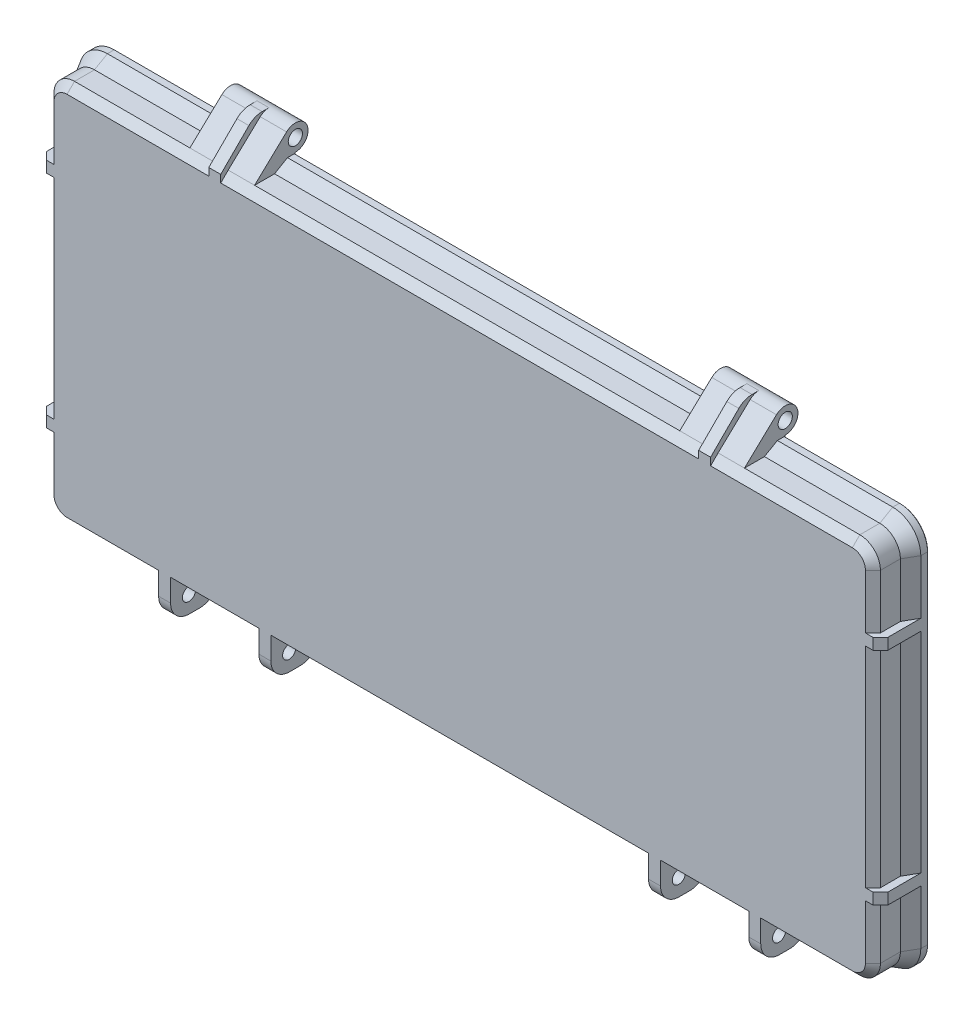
SolidWorks part; units mm, degrees
ref_plane "Front Plane" through (0, 0, 0) normal (0, 0, 1) x (1, 0, 0)
ref_plane "Top Plane" through (0, 0, 0) normal (0, 1, 0) x (1, 0, 0)
ref_plane "Right Plane" through (0, 0, 0) normal (1, 0, 0) x (0, 0, -1)
sketch "Sketch1" plane through (0, 0, 0) normal (0, 0, 1) x (1, 0, 0)
  line L1 (-105, 51) -> (105, 51)
  line L2 (-110.5, 45.5) -> (-110.5, -45.5)
  line L3 (-105, -51) -> (105, -51)
  line L4 (110.5, 45.5) -> (110.5, -45.5)
  line L5 (-110.5, 51) -> (110.5, -51) construction
  line L6 (-110.5, -51) -> (110.5, 51) construction
  arc A0 (-110.5, -45.5) -> (-105, -51) centre (-105, -45.5) ccw
  arc A1 (105, -51) -> (110.5, -45.5) centre (105, -45.5) ccw
  arc A2 (105, 51) -> (110.5, 45.5) centre (105, 45.5) cw
  arc A3 (-105, 51) -> (-110.5, 45.5) centre (-105, 45.5) ccw
  point P0 (0, 0)
  dimension "D3" = 5.5
  dimension "D1" = 221
  dimension "D2" = 102
extrude "Boss-Extrude1" add sketch "Sketch1" along normal blind 2 draft 45
sketch "Sketch2" plane through (0, 0, 0) normal (0, 0, -1) x (-1, 0, 0)
  line L4 (110.5, -45.5) -> (110.5, 45.5)
  line L5 (105, 51) -> (-105, 51)
  line L6 (-110.5, 45.5) -> (-110.5, -45.5)
  line L7 (-105, -51) -> (105, -51)
  line L8 (110.5, -45.5) -> (110.5, 45.5)
  line L9 (105, 51) -> (-105, 51)
  line L10 (-110.5, 45.5) -> (-110.5, -45.5)
  line L11 (-105, -51) -> (105, -51)
  arc A4 (105, -51) -> (110.5, -45.5) centre (105, -45.5) ccw
  arc A5 (110.5, 45.5) -> (105, 51) centre (105, 45.5) ccw
  arc A6 (-105, 51) -> (-110.5, 45.5) centre (-105, 45.5) ccw
  arc A7 (-110.5, -45.5) -> (-105, -51) centre (-105, -45.5) ccw
  arc A8 (105, -51) -> (110.5, -45.5) centre (105, -45.5) ccw
  arc A9 (110.5, 45.5) -> (105, 51) centre (105, 45.5) ccw
  arc A10 (-105, 51) -> (-110.5, 45.5) centre (-105, 45.5) ccw
  arc A11 (-110.5, -45.5) -> (-105, -51) centre (-105, -45.5) ccw
  dimension "D1" = 0
extrude "Boss-Extrude2" add sketch "Sketch2" along normal blind 8.8
sketch "Sketch3" plane through (0, 0, -8.8) normal (0, 0, -1) x (-1, 0, 0)
  line L8 (112.5, -45.5) -> (112.5, 45.5)
  line L9 (105, 53) -> (-105, 53)
  line L10 (-112.5, 45.5) -> (-112.5, -45.5)
  line L11 (-105, -53) -> (105, -53)
  line L12 (112.5, -45.5) -> (112.5, 45.5)
  line L13 (105, 53) -> (-105, 53)
  line L14 (-112.5, 45.5) -> (-112.5, -45.5)
  line L15 (-105, -53) -> (105, -53)
  arc A8 (105, -53) -> (112.5, -45.5) centre (105, -45.5) ccw
  arc A9 (112.5, 45.5) -> (105, 53) centre (105, 45.5) ccw
  arc A10 (-105, 53) -> (-112.5, 45.5) centre (-105, 45.5) ccw
  arc A11 (-112.5, -45.5) -> (-105, -53) centre (-105, -45.5) ccw
  arc A12 (105, -53) -> (112.5, -45.5) centre (105, -45.5) ccw
  arc A13 (112.5, 45.5) -> (105, 53) centre (105, 45.5) ccw
  arc A14 (-105, 53) -> (-112.5, 45.5) centre (-105, 45.5) ccw
  arc A15 (-112.5, -45.5) -> (-105, -53) centre (-105, -45.5) ccw
  dimension "D1" = 2
extrude "Boss-Extrude3" add sketch "Sketch3" along normal blind 2
sketch "Sketch4" plane through (0, 0, -8.8) normal (0, 0, 1) x (1, 0, 0)
  line L4 (-105, -53) -> (105, -53)
  line L5 (112.5, -45.5) -> (112.5, 45.5)
  line L6 (105, 53) -> (-105, 53)
  line L7 (-112.5, 45.5) -> (-112.5, -45.5)
  line L8 (-105, -53) -> (105, -53)
  line L9 (112.5, -45.5) -> (112.5, 45.5)
  line L10 (105, 53) -> (-105, 53)
  line L11 (-112.5, 45.5) -> (-112.5, -45.5)
  arc A4 (-112.5, -45.5) -> (-105, -53) centre (-105, -45.5) ccw
  arc A5 (105, -53) -> (112.5, -45.5) centre (105, -45.5) ccw
  arc A6 (112.5, 45.5) -> (105, 53) centre (105, 45.5) ccw
  arc A7 (-105, 53) -> (-112.5, 45.5) centre (-105, 45.5) ccw
  arc A8 (-112.5, -45.5) -> (-105, -53) centre (-105, -45.5) ccw
  arc A9 (105, -53) -> (112.5, -45.5) centre (105, -45.5) ccw
  arc A10 (112.5, 45.5) -> (105, 53) centre (105, 45.5) ccw
  arc A11 (-105, 53) -> (-112.5, 45.5) centre (-105, 45.5) ccw
  dimension "D1" = 0
extrude "Boss-Extrude4" add sketch "Sketch4" along normal blind 4 draft 30
sketch "Sketch5" plane through (0, 0, -10.8) normal (0, 0, -1) x (-1, 0, 0)
  line L4 (109.45, -45.5) -> (109.45, 45.5)
  line L5 (105, 49.95) -> (-105, 49.95)
  line L6 (-109.45, 45.5) -> (-109.45, -45.5)
  line L7 (-105, -49.95) -> (105, -49.95)
  line L8 (111.05, -45.5) -> (111.05, 45.5)
  line L9 (105, 51.55) -> (-105, 51.55)
  line L10 (-111.05, 45.5) -> (-111.05, -45.5)
  line L11 (-105, -51.55) -> (105, -51.55)
  line L12 (111.05, -45.5) -> (111.05, 45.5)
  line L13 (105, 51.55) -> (-105, 51.55)
  line L14 (-111.05, 45.5) -> (-111.05, -45.5)
  line L15 (-105, -51.55) -> (105, -51.55)
  arc A4 (109.45, 45.5) -> (105, 49.95) centre (105, 45.5) ccw
  arc A5 (-105, 49.95) -> (-109.45, 45.5) centre (-105, 45.5) ccw
  arc A6 (-109.45, -45.5) -> (-105, -49.95) centre (-105, -45.5) ccw
  arc A7 (105, -49.95) -> (109.45, -45.5) centre (105, -45.5) ccw
  arc A8 (105, -51.55) -> (111.05, -45.5) centre (105, -45.5) ccw
  arc A9 (111.05, 45.5) -> (105, 51.55) centre (105, 45.5) ccw
  arc A10 (-105, 51.55) -> (-111.05, 45.5) centre (-105, 45.5) ccw
  arc A11 (-111.05, -45.5) -> (-105, -51.55) centre (-105, -45.5) ccw
  arc A12 (105, -51.55) -> (111.05, -45.5) centre (105, -45.5) ccw
  arc A13 (111.05, 45.5) -> (105, 51.55) centre (105, 45.5) ccw
  arc A14 (-105, 51.55) -> (-111.05, 45.5) centre (-105, 45.5) ccw
  arc A15 (-111.05, -45.5) -> (-105, -51.55) centre (-105, -45.5) ccw
  dimension "D1" = 1.45
  dimension "D2" = 1.6
extrude "Boss-Extrude5" add sketch "Sketch5" along normal blind 0.4
sketch "Sketch6" plane through (0, 0, -11.2) normal (0, 0, -1) x (-1, 0, 0)
  line L0 (-105, -49.95) -> (105, -49.95) construction
  line L1 (109.45, -45.5) -> (109.45, 45.5) construction
  line L2 (105, 49.95) -> (-105, 49.95) construction
  line L3 (-109.45, 45.5) -> (-109.45, -45.5) construction
  line L4 (111.05, -45.5) -> (111.05, 45.5)
  line L5 (105, 51.55) -> (-105, 51.55)
  line L6 (-111.05, 45.5) -> (-111.05, -45.5)
  line L7 (-105, -51.55) -> (105, -51.55)
  line L8 (111.05, -45.5) -> (111.05, 45.5)
  line L9 (105, 51.55) -> (-105, 51.55)
  line L10 (-111.05, 45.5) -> (-111.05, -45.5)
  line L11 (-105, -51.55) -> (105, -51.55)
  line L12 (-105, -49.95) -> (105, -49.95)
  line L13 (109.45, -45.5) -> (109.45, 45.5)
  line L14 (105, 49.95) -> (-105, 49.95)
  line L15 (-109.45, 45.5) -> (-109.45, -45.5)
  arc A0 (-109.45, -45.5) -> (-105, -49.95) centre (-105, -45.5) ccw construction
  arc A1 (105, -49.95) -> (109.45, -45.5) centre (105, -45.5) ccw construction
  arc A2 (109.45, 45.5) -> (105, 49.95) centre (105, 45.5) ccw construction
  arc A3 (-105, 49.95) -> (-109.45, 45.5) centre (-105, 45.5) ccw construction
  arc A4 (105, -51.55) -> (111.05, -45.5) centre (105, -45.5) ccw
  arc A5 (111.05, 45.5) -> (105, 51.55) centre (105, 45.5) ccw
  arc A6 (-105, 51.55) -> (-111.05, 45.5) centre (-105, 45.5) ccw
  arc A7 (-111.05, -45.5) -> (-105, -51.55) centre (-105, -45.5) ccw
  arc A8 (105, -51.55) -> (111.05, -45.5) centre (105, -45.5) ccw
  arc A9 (111.05, 45.5) -> (105, 51.55) centre (105, 45.5) ccw
  arc A10 (-105, 51.55) -> (-111.05, 45.5) centre (-105, 45.5) ccw
  arc A11 (-111.05, -45.5) -> (-105, -51.55) centre (-105, -45.5) ccw
  arc A12 (-109.45, -45.5) -> (-105, -49.95) centre (-105, -45.5) ccw
  arc A13 (105, -49.95) -> (109.45, -45.5) centre (105, -45.5) ccw
  arc A14 (109.45, 45.5) -> (105, 49.95) centre (105, 45.5) ccw
  arc A15 (-105, 49.95) -> (-109.45, 45.5) centre (-105, 45.5) ccw
  dimension "D1" = 0
extrude "Boss-Extrude6" add sketch "Sketch6" along normal blind 0.6 draft 45
sketch "Sketch7" plane through (0, 0, -10.8) normal (0, 0, -1) x (-1, 0, 0)
  line L5 (-105.45, 48.5) -> (105.45, 48.5)
  line L6 (-108, 45.95) -> (-108, -45.95)
  line L7 (-105.45, -48.5) -> (105.45, -48.5)
  line L8 (108, 45.95) -> (108, -45.95)
  line L9 (-108, 48.5) -> (108, -48.5) construction
  line L10 (-108, -48.5) -> (108, 48.5) construction
  arc A0 (-108, -45.95) -> (-105.45, -48.5) centre (-105.45, -45.95) ccw
  arc A1 (105.45, -48.5) -> (108, -45.95) centre (105.45, -45.95) ccw
  arc A2 (105.45, 48.5) -> (108, 45.95) centre (105.45, 45.95) cw
  arc A3 (-105.45, 48.5) -> (-108, 45.95) centre (-105.45, 45.95) ccw
  point P0 (0, 0)
  dimension "D3" = 0
  dimension "D4" = 2.55
  dimension "D1" = 216
  dimension "D2" = 97
extrude "Cut-Extrude1" cut sketch "Sketch7" against normal offset from surface (10.8 mm away) 2
chamfer "Chamfer1" distance 0.2 angle 45 16 edges at (0, 48.5, -10.8) (107.2531, 47.7531, -10.8) (-107.2531, 47.7531, -10.8) (108, 0, -10.8) (-108, 0, -10.8) (107.2531, -47.7531, -10.8) (-107.2531, -47.7531, -10.8) (0, -48.5, -10.8) (0, 53, -10.8) (110.3033, 50.8033, -10.8) (-110.3033, 50.8033, -10.8) (112.5, 0, -10.8) (-112.5, 0, -10.8) (110.3033, -50.8033, -10.8) (-110.3033, -50.8033, -10.8) (0, -53, -10.8)
ref_plane "Plane 45mm" through (-65.5, 0, 0) normal (-1, 0, 0) x (0, 0, 1)
ref_plane "Plane 110.5mm" through (0, 0, 0) normal (-1, 0, 0) x (0, 0, 1)
ref_plane "Plane 30mm" through (-80.5, 0, 0) normal (-1, 0, 0) x (0, 0, 1)
sketch "Sketch8" plane through (-65.5, 0, 0) normal (-1, 0, 0) x (0, 0, 1)
  line L0 (-5.3359, 51) -> (-8.8, 53) construction
  line L1 (-10.6, 53) -> (-8.8, 53) construction
  line L2 (-10.8, 52.8) -> (-10.6, 53) construction
  line L3 (-5.3359, 51) -> (-8.8, 53)
  line L4 (-10.6, 53) -> (-8.8, 53)
  line L5 (-10.8, 52.8) -> (-10.6, 53)
  line L6 (-10.8, 52.8) -> (-10.8, 45.5) construction
  line L7 (-10.9, 53.2) -> (-10.8, 53.1)
  line L8 (-10.8, 53.1) -> (-10.8, 52.8)
  line L9 (-5.3359, 51) -> (0, 51) construction
  line L10 (-5.3359, 51) -> (0, 51)
  line L11 (0, 51) -> (-8.5682, 59.0744)
  arc A0 (-8.5682, 59.0744) -> (-10.9, 53.2) centre (-10.9, 56.6) ccw
  circle A1 centre (-10.9, 56.6) radius 1.9
  point P10 (0, 0)
  point P13 (0, 0)
  point P14 (0, 0)
  point P15 (0, 0)
  dimension "D1" = 6.8
  dimension "D6" = 3.8
  dimension "D2" = 0.1
  dimension "D3" = 135
  dimension "D4" = 0.2
  dimension "D5" = 43.301
extrude "Boss-Extrude7" add sketch "Sketch8" along normal mid plane 17.3
sketch "Sketch9" plane through (-65.5, 0, 0) normal (-1, 0, 0) x (0, 0, 1)
  line L0 (-5.3359, 51) -> (0, 51) construction
  line L1 (-8.8, 53) -> (-5.3359, 51) construction
  line L2 (-10.6, 53) -> (-8.8, 53) construction
  line L3 (-10.8, 52.8) -> (-10.6, 53) construction
  line L4 (-10.8, 53.1) -> (-10.8, 52.8) construction
  line L5 (-10.9, 53.2) -> (-10.8, 53.1) construction
  line L6 (-5.3359, 51) -> (0, 51)
  line L7 (-8.8, 53) -> (-5.3359, 51)
  line L8 (-10.6, 53) -> (-8.8, 53)
  line L9 (-10.8, 52.8) -> (-10.6, 53)
  line L10 (-10.8, 53.1) -> (-10.8, 52.8)
  line L11 (-10.9, 53.2) -> (-10.8, 53.1)
  line L12 (2, 49) -> (0, 51) construction
  line L13 (2, 49) -> (0, 51)
  line L14 (2, 49) -> (2, 51)
  line L15 (-10.9, 60) -> (-9.0711, 60)
  line L16 (-5.5355, 58.5355) -> (2, 51)
  arc A0 (-8.5682, 59.0744) -> (-10.9, 53.2) centre (-10.9, 56.6) ccw construction
  arc A1 (-10.9, 60) -> (-10.9, 53.2) centre (-10.9, 56.6) ccw
  arc A2 (-9.0711, 60) -> (-5.5355, 58.5355) centre (-9.0711, 55) cw
  circle A3 centre (-10.9, 56.6) radius 1.9 construction
  circle A4 centre (-10.9, 56.6) radius 1.9
  dimension "D1" = 5
extrude "Boss-Extrude8" add sketch "Sketch9" along normal mid plane 3.2
mirror "Mirror1" about plane through (0, 0, 0) normal (-1, 0, 0) of "Boss-Extrude8", "Boss-Extrude7"
sketch "Sketch10" plane through (-80.5, 0, 0) normal (-1, 0, 0) x (0, 0, 1)
  line L0 (2, -49) -> (0, -51) construction
  line L1 (-5.3359, -51) -> (0, -51) construction
  line L2 (-5.3359, -51) -> (-8.8, -53) construction
  line L3 (-10.6, -53) -> (-8.8, -53) construction
  line L4 (-10.8, -52.8) -> (-10.6, -53) construction
  line L5 (2, -49) -> (0, -51)
  line L6 (-5.3359, -51) -> (0, -51)
  line L7 (-5.3359, -51) -> (-8.8, -53)
  line L8 (-10.6, -53) -> (-8.8, -53)
  line L9 (-10.8, -52.8) -> (-10.6, -53)
  line L10 (-10.8, -52.8) -> (-10.8, -55)
  line L11 (-5.8, -60) -> (-3, -60)
  line L12 (2, -55) -> (2, -49)
  line L13 (-10.8, -45.5) -> (-10.8, -52.8) construction
  arc A0 (-3, -60) -> (2, -55) centre (-3, -55) ccw
  arc A1 (-10.8, -55) -> (-5.8, -60) centre (-5.8, -55) ccw
  circle A2 centre (-2.9, -55.3) radius 1.75
  dimension "D2" = 5
  dimension "D3" = 3.5
  dimension "D1" = 7
  dimension "D4" = 2.3
  dimension "D5" = 7.9
extrude "Boss-Extrude9" add sketch "Sketch10" against normal blind 3.2
mirror "Mirror2" about plane through (-65.5, 0, 0) normal (-1, 0, 0) of "Boss-Extrude9"
mirror "Mirror3" about plane through (0, 0, 0) normal (-1, 0, 0) of "Mirror2", "Boss-Extrude9"
ref_plane "PlaneY 20mm" through (0, -31, 0) normal (0, -1, 0) x (-1, 0, 0)
sketch "Sketch11" plane through (0, -31, 0) normal (0, -1, 0) x (-1, 0, 0)
  line L0 (108.5, -2) -> (110.5, 0) construction
  line L1 (110.5, 5.3359) -> (110.5, 0) construction
  line L2 (110.5, 5.3359) -> (112.5, 8.8) construction
  line L3 (108.5, -2) -> (110.5, 0)
  line L4 (110.5, 5.3359) -> (110.5, 0)
  line L5 (110.5, 5.3359) -> (112.5, 8.8)
  line L6 (108.5, -2) -> (110.5, -2)
  line L7 (110.5, -2) -> (112.5, 0)
  line L8 (112.5, 0) -> (112.5, 8.8)
  line L9 (-110.5, 5.3359) -> (-112.5, 8.8) construction
  line L10 (-110.5, 5.3359) -> (-110.5, 0) construction
  line L11 (-108.5, -2) -> (-110.5, 0) construction
  line L12 (-110.5, 5.3359) -> (-112.5, 8.8)
  line L13 (-110.5, 5.3359) -> (-110.5, 0)
  line L14 (-108.5, -2) -> (-110.5, 0)
  line L15 (-108.5, -2) -> (-110.5, -2)
  line L16 (-110.5, -2) -> (-112.5, 0)
  line L17 (-112.5, 0) -> (-112.5, 8.8)
  dimension "D1" = 2
  dimension "D2" = 2
extrude "Boss-Extrude10" add sketch "Sketch11" against normal blind 3
pattern_linear "LPattern1" count 2 spacing 59 along (0, 1, 0) of "Boss-Extrude10"
sketch "Sketch14" plane through (0, 0, 0) normal (0, 0, -1) x (-1, 0, 0)
  line L1 (108, -45.95) -> (108, 45.95) construction
  line L2 (92.65, 47.35) -> (105.35, 47.35)
  line L3 (91.15, 45.85) -> (91.15, -44.85)
  line L5 (92.65, -46.35) -> (105.35, -46.35)
  line L6 (106.85, 45.85) -> (106.85, -44.85)
  line L7 (91.15, 47.35) -> (106.85, -46.35) construction
  line L12 (91.15, -46.35) -> (106.85, 47.35) construction
  line L13 (105.45, 48.5) -> (-105.45, 48.5) construction
  arc A0 (105.35, -46.35) -> (106.85, -44.85) centre (105.35, -44.85) ccw
  arc A1 (91.15, -44.85) -> (92.65, -46.35) centre (92.65, -44.85) ccw
  arc A2 (105.35, 47.35) -> (106.85, 45.85) centre (105.35, 45.85) cw
  arc A3 (92.65, 47.35) -> (91.15, 45.85) centre (92.65, 45.85) ccw
  point P0 (99, 0.5)
  dimension "D3" = 1.5
  dimension "D2" = 93.7
  dimension "D1" = 15.7
  dimension "D4" = 1.15
  dimension "D5" = 1.15
extrude "Boss-Extrude13" add sketch "Sketch14" along normal blind 2
sketch "Sketch15" plane through (0, 0, -2) normal (0, 0, -1) x (-1, 0, 0)
  line L4 (105.35, 47.35) -> (92.65, 47.35)
  line L5 (106.85, -44.85) -> (106.85, 45.85)
  line L6 (106.85, -44.85) -> (106.85, 45.85)
  line L7 (91.15, 45.85) -> (91.15, -44.85)
  line L8 (105.35, 47.35) -> (92.65, 47.35)
  line L12 (91.15, 45.85) -> (91.15, -44.85)
  line L13 (92.65, -46.35) -> (105.35, -46.35)
  line L14 (92.65, -46.35) -> (105.35, -46.35)
  arc A4 (105.35, -46.35) -> (106.85, -44.85) centre (105.35, -44.85) ccw
  arc A5 (105.35, -46.35) -> (106.85, -44.85) centre (105.35, -44.85) ccw
  arc A6 (106.85, 45.85) -> (105.35, 47.35) centre (105.35, 45.85) ccw
  arc A7 (106.85, 45.85) -> (105.35, 47.35) centre (105.35, 45.85) ccw
  arc A12 (92.65, 47.35) -> (91.15, 45.85) centre (92.65, 45.85) ccw
  arc A13 (92.65, 47.35) -> (91.15, 45.85) centre (92.65, 45.85) ccw
  arc A14 (91.15, -44.85) -> (92.65, -46.35) centre (92.65, -44.85) ccw
  arc A15 (91.15, -44.85) -> (92.65, -46.35) centre (92.65, -44.85) ccw
  dimension "D1" = 0
extrude "Boss-Extrude14" add sketch "Sketch15" along normal blind 0.7 draft 45
sketch "Sketch16" plane through (0, 0, -2.7) normal (0, 0, -1) x (-1, 0, 0)
  line L8 (105.35, 46.15) -> (92.65, 46.15)
  line L9 (92.35, 45.85) -> (92.35, -44.85)
  line L10 (92.65, -45.15) -> (105.35, -45.15)
  line L11 (105.65, -44.85) -> (105.65, 45.85)
  line L12 (105.35, 46.15) -> (92.65, 46.15)
  line L13 (92.35, 45.85) -> (92.35, -44.85)
  line L14 (92.65, -45.15) -> (105.35, -45.15)
  line L15 (105.65, -44.85) -> (105.65, 45.85)
  arc A8 (105.65, 45.85) -> (105.35, 46.15) centre (105.35, 45.85) ccw
  arc A9 (92.65, 46.15) -> (92.35, 45.85) centre (92.65, 45.85) ccw
  arc A10 (92.35, -44.85) -> (92.65, -45.15) centre (92.65, -44.85) ccw
  arc A11 (105.35, -45.15) -> (105.65, -44.85) centre (105.35, -44.85) ccw
  arc A12 (105.65, 45.85) -> (105.35, 46.15) centre (105.35, 45.85) ccw
  arc A13 (92.65, 46.15) -> (92.35, 45.85) centre (92.65, 45.85) ccw
  arc A14 (92.35, -44.85) -> (92.65, -45.15) centre (92.65, -44.85) ccw
  arc A15 (105.35, -45.15) -> (105.65, -44.85) centre (105.35, -44.85) ccw
  dimension "D1" = 0.5
extrude "Cut-Extrude2" cut sketch "Sketch16" against normal blind 0.7 draft 45
sketch "Sketch17" plane through (0, 0, -2) normal (0, 0, -1) x (-1, 0, 0)
  line L4 (104.95, 45.45) -> (93.05, 45.45)
  line L5 (93.05, 45.45) -> (93.05, -44.45)
  line L6 (93.05, -44.45) -> (104.95, -44.45)
  line L7 (104.95, -44.45) -> (104.95, 45.45)
  line L8 (104.95, 45.45) -> (93.05, 45.45)
  line L9 (93.05, 45.45) -> (93.05, -44.45)
  line L10 (93.05, -44.45) -> (104.95, -44.45)
  line L11 (104.95, -44.45) -> (104.95, 45.45)
  dimension "D1" = 0
extrude "Cut-Extrude3" cut sketch "Sketch17" against normal up to surface (2 mm away)
chamfer "Chamfer2" distance 0.4 angle 45 8 edges at (-106.85, 0.5, 0) (-106.4107, 46.9107, 0) (-106.4107, -45.9107, 0) (-99, 47.35, 0) (-99, -46.35, 0) (-91.5893, 46.9107, 0) (-91.5893, -45.9107, 0) (-91.15, 0.5, 0)
chamfer "Chamfer3" distance 0.4 angle 45 4 edges at (-99, -44.45, 0) (-104.95, 0.5, 0) (-99, 45.45, 0) (-93.05, 0.5, 0)
pattern_linear "LPattern2" count 12 spacing 18 along (1, 0, 0) of "Chamfer3", "Chamfer2", "Cut-Extrude3", "Cut-Extrude2", "Boss-Extrude14", "Boss-Extrude13"
sketch "Sketch19" plane through (106.85, 0, 0) normal (-1, 0, 0) x (0, 0, 1)
  line L1 (0, 47.2) -> (0, 48)
  line L2 (0, 48) -> (-2.7, 48)
  line L3 (0, 47.2) -> (-2.7, 44.5)
  line L4 (-2.7, 44.5) -> (-2.7, 48)
  line L5 (0, 48.5) -> (-10.6, 48.5) construction
  line L11 (-2.7, 46.15) -> (-2.7, 45.85) construction
  line L12 (0, 48.5) -> (0, 45.95) construction
  dimension "D1" = 0.5
  dimension "D2" = 0.8
  dimension "D3" = 135
extrude "Cut-Extrude4" cut sketch "Sketch19" along normal up to surface (213.7 mm away)
